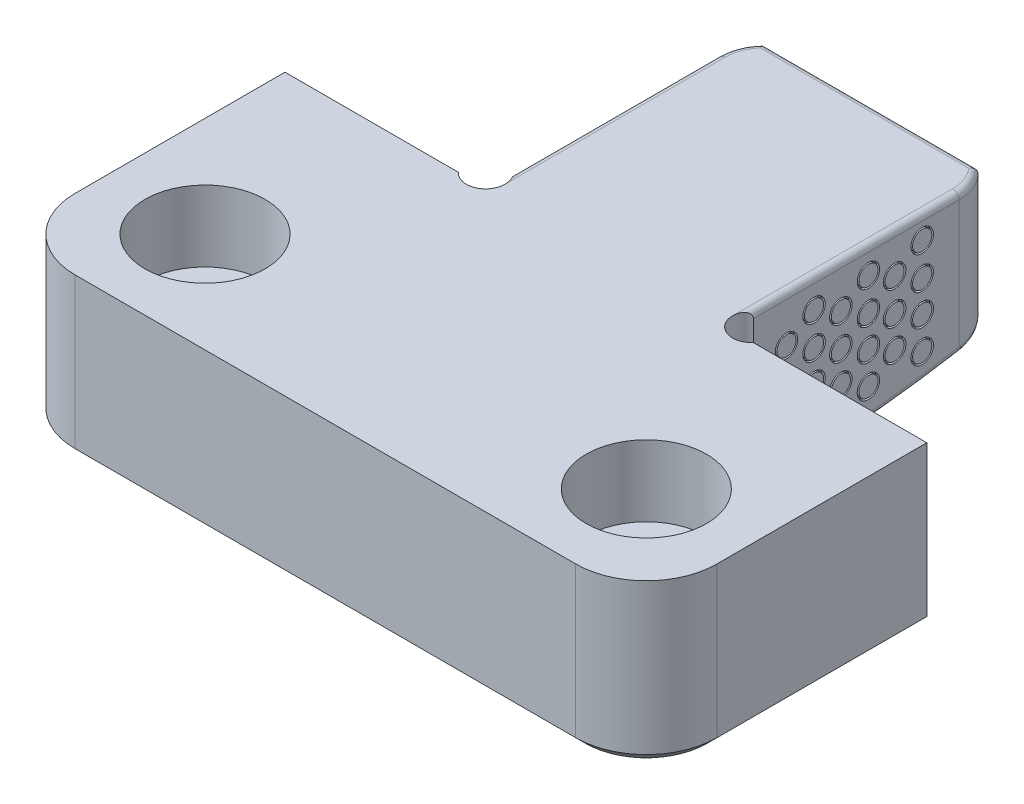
SolidWorks part; units mm, degrees
ref_plane "Front Plane" through (0, 0, 0) normal (0, 0, 1) x (1, 0, 0)
ref_plane "Top Plane" through (0, 0, 0) normal (0, 1, 0) x (1, 0, 0)
ref_plane "Right Plane" through (0, 0, 0) normal (1, 0, 0) x (0, 0, -1)
sketch "Sketch1" plane through (0, 0, 0) normal (0, 1, 0) x (1, 0, 0)
  line L0 (-25.4, -22.1996) -> (25.4, -22.1996)
  line L6 (-9.5225, 0) -> (-9.5225, 20.9804)
  line L7 (-9.5225, 20.9804) -> (9.5225, 20.9804)
  line L8 (9.5225, 20.9804) -> (9.5225, 0)
  line L9 (9.5225, 0) -> (25.4, 0)
  line L10 (25.4, 0) -> (25.4, -22.1996)
  line L12 (0, 0) -> (0, 50000) construction
  line L13 (0, 0) -> (-50000, 0) construction
  line L21 (-25.4, 0) -> (-25.4, -22.1996)
  line L22 (-9.5225, 0) -> (-25.4, 0)
  dimension "D1" = 19.0449
  dimension "D2" = 22.1996
  dimension "D3" = 43.18
  dimension "D4" = 50.8
extrude "Boss-Extrude1" add sketch "Sketch1" against normal blind 12.6746 separate body
sketch "Sketch2" plane through (0, 0, 0) normal (0, 1, 0) x (1, 0, 0)
  line L0 (0, 0) -> (50000, 0) construction
  line L1 (0, 0) -> (0, 50000) construction
  line L4 (-9.5225, 20.9804) -> (-9.5225, 0) construction
  line L5 (9.5225, 20.9804) -> (-9.5225, 20.9804) construction
  line L12 (9.5225, 14.6304) -> (9.5225, 18.4404)
  line L13 (9.5225, 14.6304) -> (12.7, 14.6304)
  line L14 (12.7, 14.6304) -> (12.7, 27.3304)
  line L15 (-12.7, 27.3304) -> (12.7, 27.3304)
  line L16 (-12.7, 14.6304) -> (-12.7, 27.3304)
  line L17 (-9.5225, 14.6304) -> (-12.7, 14.6304)
  line L18 (-9.5225, 14.6304) -> (-9.5225, 18.4404)
  line L19 (-8.4701, 20.9804) -> (8.4701, 20.9804)
  arc A0 (9.5225, 18.4404) -> (9.1924, 20.4609) centre (3.1725, 18.4404) ccw construction
  arc A1 (9.1924, 20.4609) -> (8.4701, 20.9804) centre (8.4701, 20.2184) ccw construction
  arc A2 (9.5225, 18.4404) -> (8.4701, 20.9804) centre (5.9311, 18.4404) ccw
  arc A6 (-9.1924, 20.4609) -> (-8.4701, 20.9804) centre (-8.4701, 20.2184) cw construction
  arc A7 (-9.5225, 18.4404) -> (-9.1924, 20.4609) centre (-3.1725, 18.4404) cw construction
  arc A8 (-9.5225, 18.4404) -> (-8.4701, 20.9804) centre (-5.9311, 18.4404) cw
  dimension "D1" = 6.35
  dimension "D3" = 25.4
  dimension "D4" = 0.762
  dimension "D5" = 6.35
  dimension "D6" = 2.54
  dimension "D2" = 12.7
extrude "Cut-Extrude1" cut sketch "Sketch2" against normal through all
sketch "Sketch3" plane through (0, 0, 0) normal (0, 1, 0) x (1, 0, 0)
  line L0 (0, 0) -> (0, 50000) construction
  line L1 (0, 0) -> (50000, 0) construction
  line L6 (25.4, -0.508) -> (9.5225, -0.508)
  line L7 (25.4, -0.508) -> (9.5225, -0.508) construction
  line L9 (9.0145, 0) -> (9.0145, 18.4404)
  line L10 (9.0145, 0) -> (9.0145, 18.4404) construction
  circle A0 centre (10.5385, 1.016) radius 1.524
  circle A1 centre (-10.5385, 1.016) radius 1.524
  dimension "D1" = 1.524
  dimension "D2" = 0.508
  dimension "D3" = 0.508
extrude "Cut-Extrude2" cut sketch "Sketch3" against normal through all
sketch "Sketch5" plane through (25.4, 0, 0) normal (1, 0, 0) x (0, 0, -1)
  line L0 (-63.088, -12.4206) -> (49936.912, -12.4206) construction
  line L1 (-22.1996, -12.6746) -> (0, -12.6746) construction
  line L2 (20.9804, -12.6746) -> (20.9804, 0) construction
  line L3 (0, 9.7237) -> (0, -49990.2763) construction
  line L4 (0, -12.6746) -> (0, 0) construction
  line L5 (-11.0998, 0) -> (-11.0998, 50000) construction
  line L6 (-22.1996, 0) -> (0, 0) construction
  line L7 (0, -12.4206) -> (0, -36.7038)
  line L8 (0, -12.4206) -> (3.2004, -12.4206)
  line L9 (50.8, 1.3962) -> (50.8, -36.7038)
  line L10 (50.8, -36.7038) -> (0, -36.7038)
  arc A0 (3.2004, -12.4206) -> (50.8, 1.3962) centre (3.2004, 76.4794) ccw
  point P16 (-11.0998, 0)
  dimension "D2" = 88.9
  dimension "D3" = 17.78
  dimension "D1" = 0.254
  dimension "D4" = 38.1
  dimension "D5" = 50.8
extrude "Cut-Extrude3" cut sketch "Sketch5" against normal through all
fillet "Fillet1" radius 5.588 2 edges at (-25.4, -6.3373, 22.1996) (25.4, -6.3373, 22.1996)
fillet "Fillet2" radius 0.508 12 edges at (-9.1739, -10.822, -19.9838) (9.314, -10.8862, -19.646) (9.5225, 0, -10.2962) (-9.2489, 0, -19.8151) (0, -10.6245, -20.9804) (-9.5225, -12.091, -10.8488) (9.5225, -12.091, -10.8488) (9.2489, 0, -19.8151) (0, 0, -20.9804) (-9.5225, 0, -10.2962) (-9.5225, -12.4206, -2.6762) (9.5225, -12.4206, -2.6762)
chamfer "Chamfer3" distance 0.762 angle 45 5 edges at (-25.4, -12.6746, 8.3058) (-23.7633, -12.6746, 20.5629) (0, -12.6746, 22.1996) (23.7633, -12.6746, 20.5629) (25.4, -12.6746, 8.3058)
hole_wizard "#10 CBORE" positions "Sketch7" profile "Sketch6" counterbore size "#10" standard "Ansi Inch"
sketch "Sketch7" plane through (0, 0, 0) normal (0, 1, 0) x (-1, 0, 0)
  line L0 (0, 0) -> (0, 50000) construction
  line L1 (0, 0) -> (50000, 0) construction
  line L2 (25.4, 0) -> (25.4, 16.6116) construction
  line L3 (19.812, 22.1996) -> (-19.812, 22.1996) construction
  point P0 (17.4625, 14.2621)
  point P16 (-17.4625, 14.2621)
  dimension "D1" = 7.9375
  dimension "D2" = 7.9375
sketch "Sketch6" plane through (-17.4625, 0, 14.2621) normal (1, 0, 0) x (0, 0, 1)
  line L0 (0, 0) -> (0, 12.6746)
  line L1 (0, 12.6746) -> (2.5527, 12.6746)
  line L3 (2.5527, 12.6746) -> (2.5527, 5.6197)
  line L4 (2.5527, 5.6197) -> (4.7625, 5.6197)
  line L5 (4.7625, 5.6197) -> (4.7625, 0)
  line L7 (4.7625, 0) -> (0, 0)
  line L11 (0, -6.35) -> (0, 107.95) construction
  dimension "Thru Hole Dia." = 5.1054
  dimension "Thru Hole Depth" = 12.6746
  dimension "C'Bore Dia." = 9.525
  dimension "C'Bore Depth" = 5.6197
sketch "Sketch8" plane through (9.5225, 0, 0) normal (1, 0, 0) x (0, 0, -1)
  circle A0 centre (15.5131, -1.8266) radius 0.889
  circle A1 centre (15.5131, -1.8266) radius 0.762
  circle A2 centre (15.5105, -9.4437) radius 0.889
  circle A3 centre (15.5105, -9.4437) radius 0.762
  circle A4 centre (15.5131, -6.9103) radius 0.889
  circle A5 centre (15.5131, -6.9103) radius 0.762
  circle A6 centre (15.5131, -4.4225) radius 0.889
  circle A7 centre (15.5131, -4.4225) radius 0.762
  circle A8 centre (13.3295, -3.1805) radius 0.889
  circle A9 centre (13.3295, -3.1805) radius 0.762
  circle A10 centre (11.259, -2.0959) radius 0.889
  circle A11 centre (11.259, -2.0959) radius 0.762
  circle A12 centre (13.3295, -8.2642) radius 0.889
  circle A13 centre (13.3295, -8.2642) radius 0.762
  circle A14 centre (13.3295, -5.7764) radius 0.889
  circle A15 centre (13.3295, -5.7764) radius 0.762
  circle A16 centre (11.2563, -9.713) radius 0.889
  circle A17 centre (11.2563, -9.713) radius 0.762
  circle A18 centre (11.259, -7.1796) radius 0.889
  circle A19 centre (11.259, -7.1796) radius 0.762
  circle A20 centre (11.259, -4.6918) radius 0.889
  circle A21 centre (11.259, -4.6918) radius 0.762
  circle A22 centre (9.0753, -3.4498) radius 0.889
  circle A23 centre (9.0753, -3.4498) radius 0.762
  circle A24 centre (9.0753, -8.5335) radius 0.889
  circle A25 centre (9.0753, -8.5335) radius 0.762
  circle A26 centre (9.0753, -6.0457) radius 0.889
  circle A27 centre (9.0753, -6.0457) radius 0.762
  circle A28 centre (6.9535, -2.3259) radius 0.889
  circle A29 centre (6.9535, -2.3259) radius 0.762
  circle A30 centre (6.9509, -9.9431) radius 0.889
  circle A31 centre (6.9509, -9.9431) radius 0.762
  circle A32 centre (6.9535, -7.4096) radius 0.889
  circle A33 centre (6.9535, -7.4096) radius 0.762
  circle A34 centre (6.9535, -4.9219) radius 0.889
  circle A35 centre (6.9535, -4.9219) radius 0.762
  circle A36 centre (4.7699, -3.6798) radius 0.889
  circle A37 centre (4.7699, -3.6798) radius 0.762
  circle A38 centre (4.7699, -8.7635) radius 0.889
  circle A39 centre (4.7699, -8.7635) radius 0.762
  circle A40 centre (4.7699, -6.2758) radius 0.889
  circle A41 centre (4.7699, -6.2758) radius 0.762
  dimension "D1" = 1.524
  dimension "D2" = 1.778
extrude "Cut-Extrude4" cut sketch "Sketch8" against normal blind 0.254
mirror "Mirror1" about plane through (0, 0, 0) normal (1, 0, 0) of "Cut-Extrude4"
